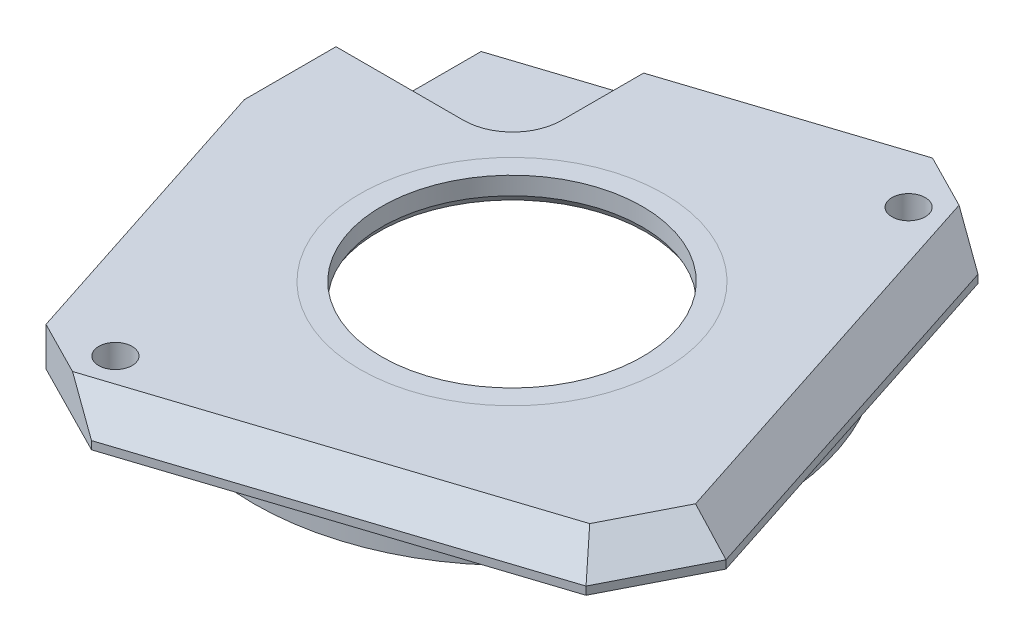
SolidWorks part; units mm, degrees
ref_plane "Front Plane" through (0, 0, 0) normal (0, 0, 1) x (1, 0, 0)
ref_plane "Top Plane" through (0, 0, 0) normal (0, 1, 0) x (1, 0, 0)
ref_plane "Right Plane" through (0, 0, 0) normal (1, 0, 0) x (0, 0, -1)
sketch "Sketch1" plane through (0, 0, 0) normal (0, 1, 0) x (1, 0, 0)
  circle A0 centre (0, 0) radius 15.24 construction
  circle A1 centre (0, 0) radius 27 construction
  circle A2 centre (0, 0) radius 13.4938
  circle A3 centre (0, 0) radius 40.64
  circle A4 centre (13.8616, 27.2049) radius 1.7272 construction
  circle A5 centre (27.205, -13.8617) radius 1.7272 construction
  circle A6 centre (-13.8616, -27.205) radius 1.7272 construction
  circle A7 centre (13.8616, 27.2049) radius 1.7272
  circle A8 centre (27.205, -13.8617) radius 1.7272 construction
  circle A9 centre (-13.8616, -27.205) radius 1.7272
  dimension "D1" = 54
  dimension "D2" = 30.48
  dimension "D3" = 26.9875
  dimension "D4" = 81.28
extrude "Boss-Extrude1" add sketch "Sketch1" along normal blind 4.0056
sketch "Sketch2" plane through (0, 4.0056, 0) normal (0, 1, 0) x (1, 0, 0)
  line L0 (-13.4112, 35.5599) -> (-13.4112, 21.5899) construction
  line L1 (-13.4112, 21.5899) -> (-13.4112, 12.6999) construction
  line L2 (-13.4112, 35.5599) -> (-13.4112, 21.5899) construction
  line L3 (-13.4112, 21.5899) -> (-13.4112, 12.6999) construction
  line L4 (-23.495, 12.6999) -> (-14.224, 12.6999) construction
  line L5 (-23.495, 12.6999) -> (-14.224, 12.6999) construction
  line L6 (-23.495, 12.6999) -> (-34.417, 12.6999) construction
  line L7 (-23.495, 12.6999) -> (-34.417, 12.6999) construction
  line L8 (-24.9894, 31.5979) -> (3.3858, 33.6319) construction
  line L9 (-24.9894, 31.5979) -> (3.3858, 33.6319) construction
  line L10 (-34.4678, -12.7001) -> (-34.4678, 12.6999) construction
  line L11 (-34.4678, -12.7001) -> (-34.4678, 12.6999) construction
  circle A0 centre (-2.4592, -33.4008) radius 1.2891 construction
  circle A1 centre (-2.4592, -33.4008) radius 1.289 construction
  circle A2 centre (34.5231, -6.6508) radius 3.683 construction
  circle A3 centre (34.5231, -6.6508) radius 3.683 construction
  circle A4 centre (30.2144, 21.3228) radius 3.175 construction
  circle A5 centre (21.8469, 29.8376) radius 3.175 construction
  circle A6 centre (30.2144, 21.3228) radius 3.175 construction
  circle A7 centre (21.8469, 29.8376) radius 3.175 construction
  circle A8 centre (0, 0) radius 27 construction
  circle A9 centre (0, 0) radius 30.175 construction
  circle A10 centre (0, 0) radius 20.32 construction
  dimension "D1" = 54
  dimension "D3" = 40.64
  dimension "D2" = 3.175
sketch "Sketch3" plane through (0, 0, 0) normal (0, -1, 0) x (1, 0, 0)
  circle A0 centre (0, 0) radius 21.59
  dimension "D1" = 43.18
extrude "Cut-Extrude1" cut sketch "Sketch3" against normal blind 1.524
sketch "Sketch7" plane through (0, 0, 0) normal (0, -1, 0) x (1, 0, 0)
  circle A0 centre (0, 0) radius 26.746
  circle A1 centre (0, 0) radius 21.59
  circle A2 centre (0, 0) radius 21.59 construction
  dimension "D1" = 53.492
extrude "Boss-Extrude2" add sketch "Sketch7" along normal blind 2.54
sketch "Sketch5" plane through (0, 4.0056, 0) normal (0, 1, 0) x (1, 0, 0)
  line L0 (-30.175, 2.4534) -> (-17.9386, -35.2065)
  line L1 (-30.175, 2.4534) -> (-30.175, 11.1124)
  line L5 (-10.2362, 26.0519) -> (-30.175, 19.5734)
  line L6 (-13.8616, -27.205) -> (27.205, -13.8617) construction
  line L7 (27.205, -13.8617) -> (13.8616, 27.2049) construction
  line L8 (17.9386, 35.2065) -> (35.2065, -17.9386)
  line L9 (35.2065, -17.9386) -> (-17.9386, -35.2065)
  line L10 (-30.175, 11.1124) -> (-30.175, 19.5734)
  line L11 (17.9386, 35.2065) -> (-10.2362, 26.0519)
  line L12 (-26.5725, -8.6339) -> (26.5725, 8.6339) construction
  line L13 (-8.6339, 26.5725) -> (8.6339, -26.5725) construction
  circle A0 centre (0, 0) radius 30.175 construction
  circle A1 centre (13.8616, 27.2049) radius 1.7272 construction
  circle A5 centre (0, 0) radius 71.9432
  dimension "D3" = 55.88
  dimension "D4" = 55.88
extrude "Cut-Extrude2" cut sketch "Sketch5" against normal up to next
chamfer "Chamfer1" distance 7.62 angle 45 3 edges at (17.9386, 2.0028, -35.2065) (35.2065, 2.0028, 17.9386) (-17.9386, 2.0028, 35.2065)
chamfer "Chamfer2" distance 3.175 angle 45 3 edges at (26.5725, 4.0056, -8.6339) (30.4056, 4.0056, 15.4924) (8.6339, 4.0056, 26.5725)
sketch "Sketch6" plane through (0, 4.0056, 0) normal (0, 1, 0) x (1, 0, 0)
  circle A0 centre (0, 0) radius 15.748
  dimension "D1" = 31.496
fillet "Fillet2" radius 2.54 1 edges at (0, 1.524, -21.59)
sketch "Sketch8" plane through (0, 4.0056, 0) normal (0, 1, 0) x (1, 0, 0)
  line L0 (-11.887, 11.9534) -> (-11.887, 31.663)
  line L2 (-11.887, 11.9534) -> (-33.2364, 11.9534)
  line L3 (-30.175, 19.5734) -> (-30.175, 2.4534) construction
  line L4 (-33.2364, 11.9534) -> (-33.2364, 31.663)
  line L5 (-33.2364, 31.663) -> (-11.887, 31.663)
  dimension "D1" = 18.288
  dimension "D2" = 7.62
extrude "Cut-Extrude3" cut sketch "Sketch8" along direction (0, 1, 0) on the side against the normal blind 2.3546
fillet "Fillet3" radius 5.08 1 edges at (-11.887, 2.8283, -11.9534)
sketch "Sketch9" plane through (0, 1.651, 0) normal (0, 1, 0) x (1, 0, 0)
  line L0 (-30.175, 11.9534) -> (-24.587, 11.9534)
  line L1 (-30.175, 11.9534) -> (-16.967, 11.9534) construction
  line L2 (-24.587, 11.9534) -> (-24.587, 23.6517)
  line L3 (-24.587, 23.6517) -> (-30.175, 23.6517)
  line L4 (-30.175, 23.6517) -> (-30.175, 11.9534)
  dimension "D1" = 5.588
extrude "Cut-Extrude4" cut sketch "Sketch9" against normal up to surface (1.651 mm away)
chamfer "Chamfer3" distance 0.635 angle 30 1 edges at (0, 1.524, -13.4937)
